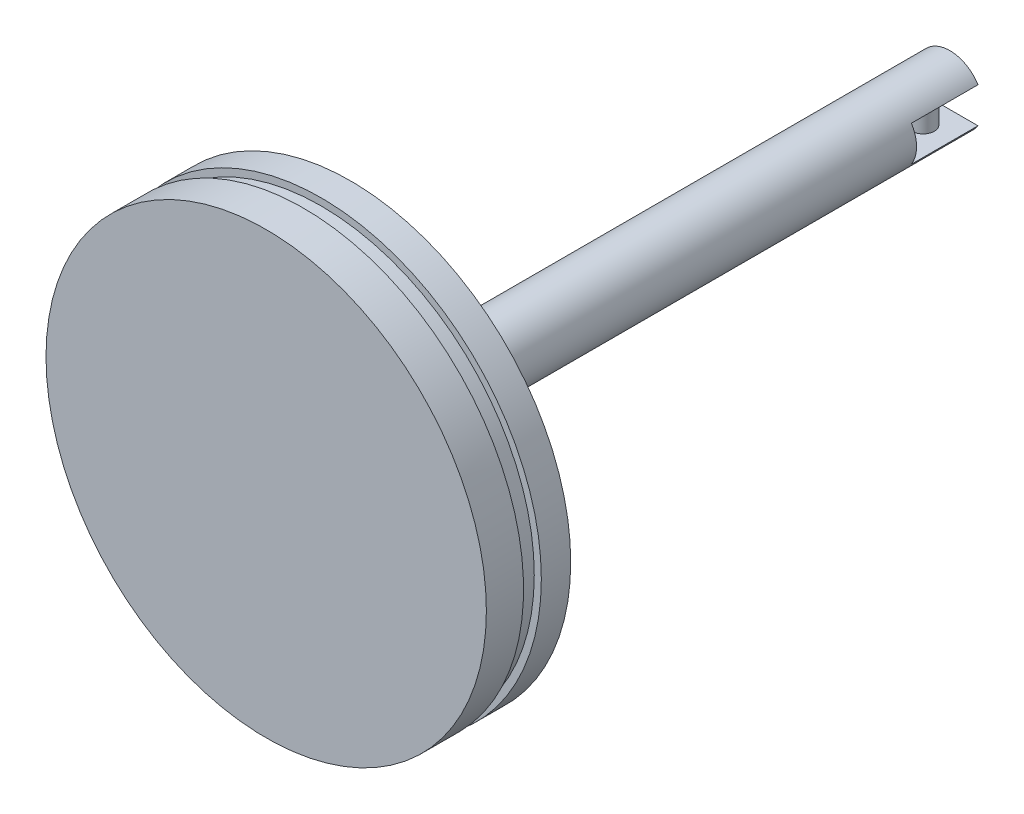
SolidWorks part; units mm, degrees
ref_plane "Front Plane" through (0, 0, 0) normal (0, 0, 1) x (1, 0, 0)
ref_plane "Top Plane" through (0, 0, 0) normal (0, 1, 0) x (1, 0, 0)
ref_plane "Right Plane" through (0, 0, 0) normal (1, 0, 0) x (0, 0, -1)
sketch "Sketch1" plane through (0, 0, 0) normal (0, 0, 1) x (1, 0, 0)
  circle A0 centre (0, 0) radius 49.6
  dimension "D1" = 99.2
extrude "Boss-Extrude1" add sketch "Sketch1" along normal blind 3
sketch "Sketch2" plane through (0, 0, 0) normal (0, 0, 1) x (1, 0, 0)
  circle A0 centre (0, 0) radius 49.6
  circle A1 centre (0, 0) radius 46
  dimension "D1" = 92
extrude "Boss-Extrude2" add sketch "Sketch2" along normal blind 15
ref_plane "Plane1" through (0, 0, 15) normal (0, 0, 1) x (1, 0, 0)
sketch "Sketch3" plane through (0, 0, 15) normal (0, 0, 1) x (1, 0, 0)
  circle A0 centre (0, 0) radius 49.6
extrude "Boss-Extrude3" add sketch "Sketch3" along normal blind 4
sketch "Sketch4" plane through (0, 0, 3) normal (0, 0, 1) x (1, 0, 0)
  circle A0 centre (-35.9876, -3.6797) radius 2.5
  circle A1 centre (-20.9712, -26.3718) radius 2.5
  circle A2 centre (10.7974, -30.7469) radius 2.5
  circle A3 centre (29.0283, -5.2297) radius 2.5
  circle A4 centre (17.4025, 21.9192) radius 2.5
  circle A5 centre (-12.5554, 26.333) radius 2.5
  circle A6 centre (0, 0) radius 5
  dimension "D1" = 5
  dimension "D2" = 5
  dimension "D3" = 5
  dimension "D4" = 5
  dimension "D5" = 5
  dimension "D6" = 5
  dimension "D7" = 10
extrude "Boss-Extrude4" add sketch "Sketch4" along normal blind 16
sketch "Sketch5" plane through (0, 0, 0) normal (0, 0, 1) x (1, 0, 0)
  circle A0 centre (0, 0) radius 7.5
  dimension "D1" = 15
extrude "Boss-Extrude5" add sketch "Sketch5" against normal blind 135
sketch "Sketch6" plane through (0, 0, 0) normal (1, 0, 0) x (0, 0, -1)
  line L0 (0, 0) -> (-20.0762, 0) construction
  line L1 (-6.6203, -50.8877) -> (-10.6203, -50.8877)
  line L2 (-6.6203, -50.8877) -> (-6.6203, -48.0104)
  line L3 (-6.6203, -48.0104) -> (-10.6203, -48.0104)
  line L4 (-10.6203, -50.8877) -> (-10.6203, -48.0104)
  dimension "D1" = 4
revolve "Cut-Revolve1" cut sketch "Sketch6" angle 360 about L0
ref_plane "Plane2" through (0, 0, -135) normal (0, 0, -1) x (-1, 0, 0)
sketch "Sketch7" plane through (0, 0, -135) normal (0, 0, -1) x (-1, 0, 0)
  line L0 (10.6083, 4) -> (-10.6083, 4)
  line L1 (10.6083, 4) -> (10.6083, -4)
  line L2 (-10.6083, 4) -> (-10.6083, -4)
  line L3 (10.6083, -4) -> (-10.6083, -4)
  line L4 (10.6083, 4) -> (-10.6083, -4) construction
  line L5 (-10.6083, 4) -> (10.6083, -4) construction
  point P1 (0, 0)
  dimension "D1" = 8
extrude "Cut-Extrude1" cut sketch "Sketch7" against normal blind 15
ref_plane "Plane3" through (0, -4, 0) normal (0, 1, 0) x (1, 0, 0)
sketch "Sketch8" plane through (0, -4, 0) normal (0, 1, 0) x (1, 0, 0)
  line L0 (8.25, 135) -> (-8.25, 135) construction
  circle A0 centre (0, 129) radius 2.5
  dimension "D1" = 5
  dimension "D2" = 6
extrude "Boss-Extrude6" add sketch "Sketch8" along normal blind 7
